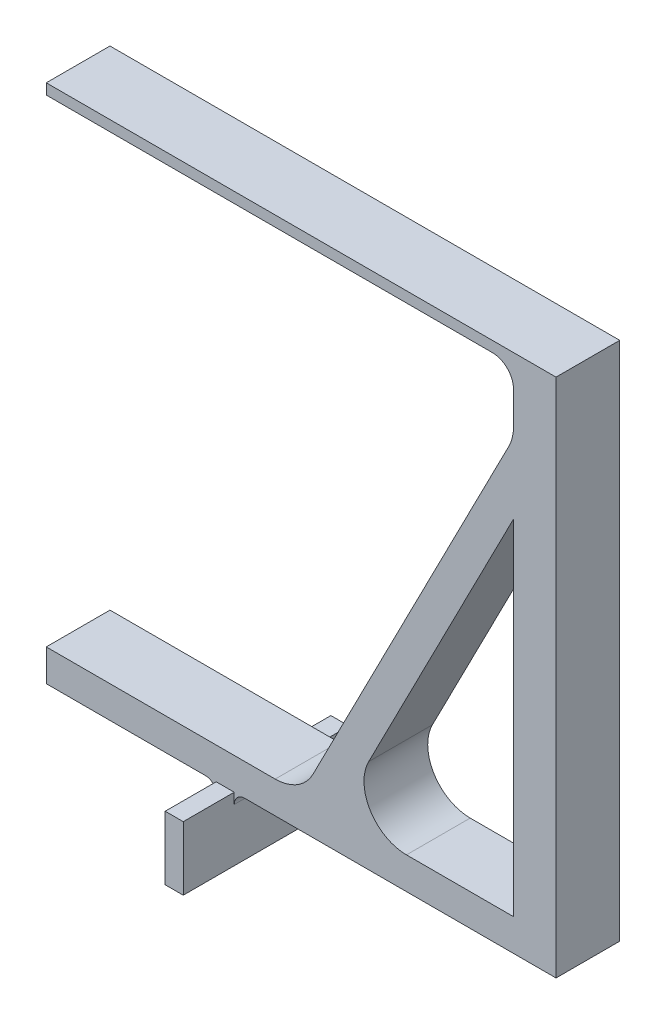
SolidWorks part; units mm, degrees
ref_plane "Front Plane" through (0, 0, 0) normal (0, 0, 1) x (1, 0, 0)
ref_plane "Top Plane" through (0, 0, 0) normal (0, 1, 0) x (1, 0, 0)
ref_plane "Right Plane" through (0, 0, 0) normal (1, 0, 0) x (0, 0, -1)
sketch "Sketch1" plane through (0, 0, 0) normal (0, 0, 1) x (1, 0, 0)
  line L2 (0, 3) -> (0, 0)
  line L3 (0, 0) -> (0.85, 0)
  line L4 (0.85, 3) -> (0.85, 0)
  line L5 (-4, 4.5) -> (4, 4.5)
  line L7 (0.85, 3) -> (16, 3)
  line L10 (16, 3) -> (16, 27.5)
  line L12 (14, 4.5) -> (14, 20.7128)
  line L13 (14, 27.5) -> (-8, 27.5)
  line L15 (14, 27) -> (-8, 27)
  line L16 (-8, 27.5) -> (-8, 27)
  line L17 (14, 27.5) -> (16, 27.5)
  line L18 (14, 24) -> (4, 4.5)
  line L19 (5.6857, 4.5) -> (14, 20.7128)
  line L20 (5.6857, 4.5) -> (14, 4.5)
  line L21 (14, 24) -> (14, 27)
  line L25 (0, 3) -> (-4, 3)
  line L26 (-4, 4.5) -> (-4, 3)
  dimension "D1" = 0.85
  dimension "D2" = 1.5
  dimension "D3" = 3
  dimension "D4" = 24
  dimension "D5" = 0.5
  dimension "D6" = 22
  dimension "D7" = 2
  dimension "D8" = 8
  dimension "D9" = 1.5
  dimension "D10" = 18
  dimension "D11" = 3
  dimension "D12" = 4
extrude "Boss-Extrude1" add sketch "Sketch1" along normal blind 3
fillet "Fillet1" radius 2 3 edges at (14, 24, 1.5) (4, 4.5, 1.5) (5.6857, 4.5, 1.5)
fillet "Fillet2" radius 1 1 edges at (14, 27, 1.5)
sketch "Sketch2" plane through (0, 0, 3) normal (0, 0, 1) x (1, 0, 0)
  line L1 (0, 0) -> (0.85, 0)
  line L2 (0, 0) -> (0, 3)
  line L3 (0, 3) -> (0.85, 3)
  line L4 (0.85, 0) -> (0.85, 3)
extrude "Boss-Extrude2" add sketch "Sketch2" along normal blind 2.4 and the other way blind 5.4
fillet "Fillet3" radius 0.5 2 edges at (0, 3, 1.5) (0.85, 3, 1.5)
sketch "Sketch3" plane through (-4, 0, 0) normal (-1, 0, 0) x (0, 0, 1)
  line L1 (0, 3) -> (3, 3)
  line L2 (0, 3) -> (0, 4.5)
  line L3 (0, 4.5) -> (3, 4.5)
  line L4 (3, 3) -> (3, 4.5)
extrude "Boss-Extrude3" add sketch "Sketch3" along normal blind 4
